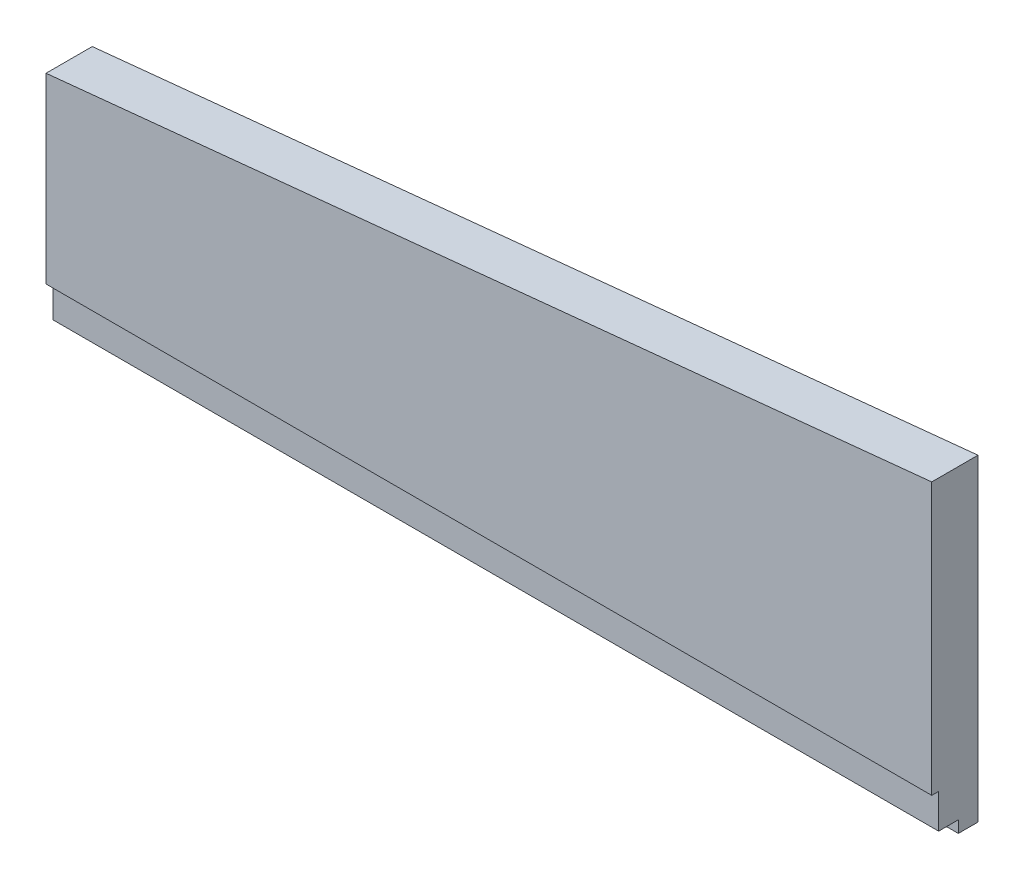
SolidWorks part; units mm, degrees
ref_plane "Спереди" through (0, 0, 0) normal (0, 0, 1) x (1, 0, 0)
ref_plane "Сверху" through (0, 0, 0) normal (0, 1, 0) x (1, 0, 0)
ref_plane "Справа" through (0, 0, 0) normal (1, 0, 0) x (0, 0, -1)
sketch "Эскиз1" plane through (0, 0, 0) normal (0, 0, 1) x (1, 0, 0)
  line L4 (0, -1510.6033) -> (0, -1786.4608)
  line L5 (-900, -1601.0003) -> (-900, -1786.4608)
  line L27 (0, -1510.6033) -> (-900, -1601.0003)
  line L39 (-900, -1786.4608) -> (0, -1786.4608)
extrude "Вытянуть1" add sketch "Эскиз1" along normal blind 47
sketch "Эскиз2" plane through (0, 0, 0) normal (0, 0, -1) x (-1, 0, 0)
  line L0 (0, -1786.4608) -> (0, -1821.4608)
  line L1 (900, -1786.4608) -> (900, -1821.4608)
  line L2 (900, -1821.4608) -> (0, -1821.4608)
  line L3 (900, -1786.4608) -> (0, -1786.4608) construction
  line L8 (0, -1786.4608) -> (900, -1786.4608)
  line L9 (900, -1786.4608) -> (900, -1601.0003)
  line L10 (900, -1601.0003) -> (0, -1510.6033)
  line L11 (0, -1510.6033) -> (0, -1786.4608)
  line L12 (0, -1786.4608) -> (900, -1786.4608)
  dimension "D1" = 35
  dimension "D2" = 0
extrude "Вытянуть2" add sketch "Эскиз2" against normal blind 40
sketch "Эскиз3" plane through (0, 0, 0) normal (0, 0, -1) x (-1, 0, 0)
  line L0 (0, -1821.4608) -> (0, -1833.4608)
  line L1 (900, -1821.4608) -> (900, -1833.4608)
  line L2 (900, -1833.4608) -> (0, -1833.4608)
  line L3 (0, -1821.4608) -> (900, -1821.4608) construction
  line L8 (0, -1510.6033) -> (0, -1821.4608)
  line L9 (0, -1821.4608) -> (900, -1821.4608)
  line L10 (900, -1821.4608) -> (900, -1601.0003)
  line L11 (900, -1601.0003) -> (0, -1510.6033)
  line L13 (0, -1821.4608) -> (900, -1821.4608)
  dimension "D1" = 12
  dimension "D2" = 0
extrude "Вытянуть3" add sketch "Эскиз3" against normal blind 20
